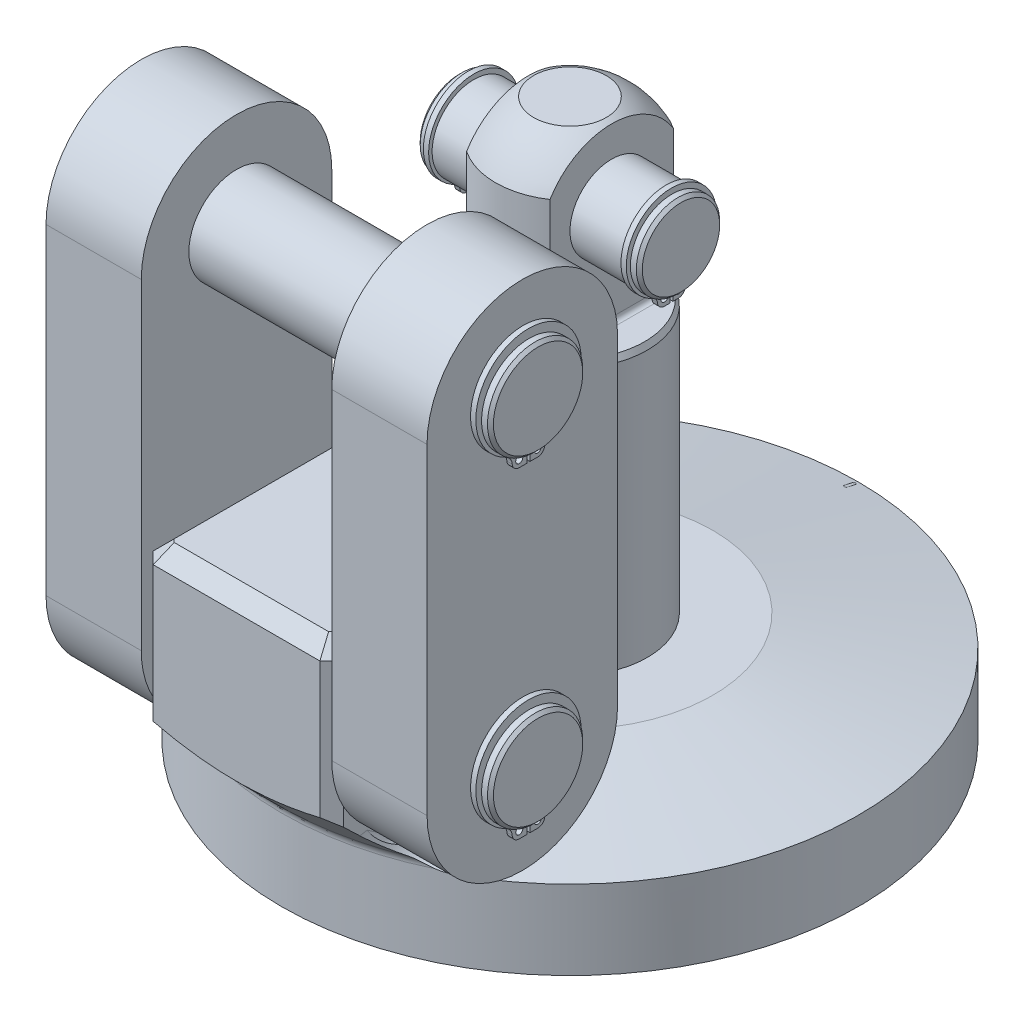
SolidWorks part; units mm, degrees
ref_plane "Front Plane" through (0, 0, 0) normal (0, 0, 1) x (1, 0, 0)
ref_plane "Top Plane" through (0, 0, 0) normal (0, 1, 0) x (1, 0, 0)
ref_plane "Right Plane" through (0, 0, 0) normal (1, 0, 0) x (0, 0, -1)
sketch "Sketch1" plane through (0, 0, 0) normal (0, 1, 0) x (1, 0, 0)
  line L0 (-16, 0) -> (16, 0)
  line L1 (16, 0) -> (16, -56)
  line L2 (16, -56) -> (-16, -56)
  line L3 (-16, -56) -> (-16, 0)
  line L4 (0, 1.05) -> (0, -22.05) construction
  dimension "D1" = 32
  dimension "D2" = 56
extrude "Extrude1" add sketch "Sketch1" along normal blind 49
sketch "S2D0003" plane through (0, 0, 0) normal (1, 0, 0) x (0, 0, -1)
  line L0 (0, 0) -> (0, 18.5)
  line L1 (-56, 0) -> (0, 0)
  line L2 (-56, 0) -> (-56, 11.6982)
  line L3 (0, 18.5) -> (-24, 18.5)
  line L4 (-24, 18.5) -> (-56, 11.6982)
  line L5 (0, 9.45) -> (0, -2.5987) construction
  line L6 (0, 49) -> (0, 0) construction
  line L8 (-56, 0) -> (0, 0) construction
  line L10 (-56, 49) -> (-56, 0) construction
  dimension "D1" = 18.5
  dimension "D2" = 12
  dimension "D3" = 48
sketch "S2D0004" plane through (0, 0, 0) normal (1, 0, 0) x (0, 0, -1)
  line L0 (-66, 31.9834) -> (-49.0508, 15.0342)
  line L1 (-48.465, 13.62) -> (-48.465, 0)
  line L2 (0, 16.6313) -> (0, -1.1122) construction
  line L3 (0, 49) -> (0, 0) construction
  line L5 (-56, 0) -> (0, 0) construction
  line L6 (-66, 31.9834) -> (-66, 0)
  line L7 (-66, 0) -> (-48.465, 0)
  line L8 (-56, 49) -> (-56, 0) construction
  arc A0 (-48.465, 13.62) -> (-49.0508, 15.0342) centre (-50.465, 13.62) ccw
  dimension "D4" = 2
  dimension "D1" = 96.93
  dimension "D2" = 13.62
  dimension "D3" = 45
  dimension "D5" = 10
sketch "Sketch4" plane through (0, 0, 0) normal (1, 0, 0) x (0, 0, -1)
  line L0 (0, 18.5) -> (24, 18.5)
  line L1 (24, 18.5) -> (24, 49)
  line L2 (24, 49) -> (0, 49)
  line L3 (0, 49) -> (0, 18.5)
  line L4 (0, 21.6) -> (0, 8.4) construction
  line L5 (0, 49) -> (0, 0) construction
  line L6 (-56, 49) -> (0, 49) construction
  dimension "D1" = 48
  dimension "D2" = 30.5
revolve "Cut-Revolve5" cut sketch "Sketch4" angle 360 about L4
revolve "Revolve1" add sketch "S2D0003" angle 360 about L5
revolve "Cut-Revolve4" cut sketch "S2D0004" angle 360 about L2
sketch "Sketch7" plane through (16, 0, 0) normal (1, 0, 0) x (0, 0, -1)
  line L0 (-48.465, 0) -> (48.465, 0) construction
  circle A0 centre (-40, 33) radius 8
  dimension "D1" = 16
  dimension "D2" = 33
  dimension "D3" = 40
extrude "Cut-Extrude3" cut sketch "Sketch7" against normal through all
fillet "Fillet1" radius 4 2 edges at (-16, 33.75, 17.8885) (16, 33.75, 17.8885)
fillet "Fillet2" radius 7.95 5 edges at (-14.0551, 18.0762, 21.8665) (0, 18.5, 24) (14.0741, 18.0719, 21.878)
chamfer "Chamfer1" distance 2 angle 45 2 edges at (-16, 36.6122, 56) (16, 36.6122, 56)
chamfer "Chamfer2" distance 2.5 angle 45 8 edges at (-16, 49, 39.6491) (-14.1381, 49, 21.9176) (0, 49, 24) (14.1381, 49, 21.9176) (-15, 49, 55) (16, 49, 39.6491) (15, 49, 55) (0, 49, 56)
ref_plane "Plane1" through (0, 0, 40) normal (0, 0, 1) x (1, 0, 0)
sketch "Sketch8" plane through (0, 0, 40) normal (0, 0, 1) x (1, 0, 0)
  line L0 (16, 33) -> (16, 16.5)
  line L1 (17.14, 15.36) -> (30.64, 15.36)
  line L2 (30.64, 15.36) -> (30.64, 33)
  line L3 (30.64, 33) -> (16, 33)
  line L4 (5.637, 33) -> (19.4125, 33) construction
  line L5 (-16, 33) -> (16, 33) construction
  line L6 (16, 49) -> (16, 24.2243) construction
  line L7 (0, 0) -> (0, 26.6501) construction
  line L8 (-30.64, 33) -> (-16, 33)
  line L9 (-30.64, 15.36) -> (-30.64, 33)
  line L10 (-17.14, 15.36) -> (-30.64, 15.36)
  line L11 (-16, 33) -> (-16, 16.5)
  arc A0 (16, 16.5) -> (17.14, 15.36) centre (17.14, 16.5) ccw
  arc A1 (-16, 16.5) -> (-17.14, 15.36) centre (-17.14, 16.5) cw
  dimension "D4" = 1.14
  dimension "D2" = 35.28
  dimension "D3" = 14.64
revolve "Cut-Revolve6" cut sketch "Sketch8" angle 360 about L4
sketch "Sketch10" plane through (0, 0, 0) normal (1, 0, 0) x (0, 0, -1)
  line L0 (0, 18.5) -> (0, 93.6)
  line L1 (0, 93.6) -> (6.1025, 93.6)
  line L2 (12.5, 87.3048) -> (12.5, 64.2723)
  line L3 (12.5, 64.2723) -> (13, 63.2)
  line L4 (13, 63.2) -> (13, 18.5)
  line L5 (13, 18.5) -> (0, 18.5)
  line L6 (0, 44.745) -> (0, 7.55) construction
  line L7 (22.759, -17.5) -> (-24.5324, -17.5) construction
  line L9 (24, 18.5) -> (-15.2237, 18.5) construction
  arc A0 (12.5, 87.3048) -> (6.1025, 93.6) centre (0, 81) ccw
  circle A1 centre (0, 81) radius 7 construction
  dimension "D2" = 14
  dimension "D3" = 14
  dimension "D5" = 98.5
  dimension "D1" = 12.6
  dimension "D4" = 36
  dimension "D6" = 26
  dimension "D7" = 25
  dimension "D8" = 25
  dimension "D9" = 30.4
  dimension "D10" = 44.7
  dimension "D11" = 75.1
revolve "Revolve2" add sketch "Sketch10" angle 360 about L6
sketch "Sketch12" plane through (0, 0, 0) normal (0, 0, 1) x (1, 0, 0)
  line L0 (7, 93.6) -> (13, 93.6)
  line L1 (13, 93.6) -> (13, 64.2)
  line L2 (13, 64.2) -> (7.8, 64.2)
  line L3 (7, 65) -> (7, 93.6)
  line L4 (6.1025, 93.6) -> (-6.1025, 93.6) construction
  line L5 (13, 18.5) -> (13, 63.2) construction
  line L6 (-7, 65) -> (-7, 93.6)
  line L7 (-13, 64.2) -> (-7.8, 64.2)
  line L8 (0, 38.525) -> (0, 26.975) construction
  line L9 (-13, 93.6) -> (-13, 64.2)
  line L10 (-7, 93.6) -> (-13, 93.6)
  arc A0 (7, 65) -> (7.8, 64.2) centre (7.8, 65) ccw
  arc A1 (-7, 65) -> (-7.8, 64.2) centre (-7.8, 65) cw
  dimension "D3" = 0.8
  dimension "D1" = 14
  dimension "D2" = 29.4
extrude "Cut-Extrude5" cut sketch "Sketch12" against normal mid plane 22
sketch "Sketch14" plane through (7, 0, 0) normal (1, 0, 0) x (0, 0, -1)
  line L0 (6.1025, 93.6) -> (-6.1025, 93.6) construction
  circle A0 centre (0, 81) radius 7
  dimension "D2" = 14
  dimension "D1" = 12.6
extrude "Cut-Extrude7" cut sketch "Sketch14" against normal up to next
sketch "S2D0005" plane through (16, 0, 0) normal (1, 0, 0) x (0, 0, -1)
  line L0 (-56.0042, 86.9988) -> (-56, 32.9988)
  line L1 (-24.0042, 87.0012) -> (-24, 33.0012)
  line L2 (-40.0042, 87) -> (-40, 33) construction
  line L3 (0, 81) -> (0.0008, 86.9944) construction
  line L4 (0.0008, 86.9944) -> (-40.0042, 87) construction
  arc A0 (-24.0042, 87.0012) -> (-56.0042, 86.9988) centre (-40.0042, 87) ccw
  arc A1 (-56, 32.9988) -> (-24, 33.0012) centre (-40, 33) ccw
  circle A2 centre (-40.0042, 87) radius 8
  circle A3 centre (-40, 33) radius 8
  circle A6 centre (-40, 33) radius 8 construction
  dimension "D2" = 54
  dimension "D1" = 32
  dimension "D3" = 40.005
  dimension "D4" = 5.9944
extrude "Extrude2" add sketch "S2D0005" along normal blind 16
sketch "S2D0006" plane through (0, 0, 0) normal (0, 0, 1) x (1, 0, 0)
  line L0 (-16.15, 88) -> (16.15, 88)
  line L1 (18.65, 87.5) -> (18.65, 81)
  line L2 (18.15, 88) -> (18.65, 87.5)
  line L3 (17.15, 88) -> (18.15, 88)
  line L4 (17.15, 87.59) -> (17.15, 88)
  line L5 (16.15, 87.59) -> (17.15, 87.59)
  line L6 (16.15, 88) -> (16.15, 87.59)
  line L7 (18.65, 81) -> (-18.65, 81)
  line L8 (-16.15, 88) -> (-16.15, 87.59)
  line L9 (-16.15, 87.59) -> (-17.15, 87.59)
  line L10 (-17.15, 87.59) -> (-17.15, 88)
  line L11 (-17.15, 88) -> (-18.15, 88)
  line L12 (-18.15, 88) -> (-18.65, 87.5)
  line L13 (-18.65, 87.5) -> (-18.65, 81)
  line L14 (-8.415, 81) -> (8.415, 81) construction
  line L15 (-7, 81) -> (7, 81) construction
  line L16 (0, 40.8686) -> (0, 24.9357) construction
  line L17 (0, 64.2723) -> (0, 87.3048) construction
  line L18 (7, 88) -> (-7, 88) construction
  dimension "D1" = 37.3
  dimension "D3" = 1
  dimension "D4" = 13.18
  dimension "D5" = 32.3
  dimension "D6" = 0.5
  dimension "D7" = 45
revolve "Revolve3" add sketch "S2D0006" angle 360 about L14
ref_plane "Plane2" through (0, 0, 40) normal (0, 0, 1) x (1, 0, 0)
sketch "Sketch18" plane through (0, 0, 40) normal (0, 0, 1) x (1, 0, 0)
  line L0 (-32.15, 41) -> (32.15, 41)
  line L1 (34.65, 40.5) -> (34.65, 33)
  line L2 (34.15, 41) -> (34.65, 40.5)
  line L3 (33.15, 41) -> (34.15, 41)
  line L4 (33.15, 40.1) -> (33.15, 41)
  line L5 (32.15, 40.1) -> (33.15, 40.1)
  line L6 (32.15, 41) -> (32.15, 40.1)
  line L7 (-32.15, 41) -> (-32.15, 40.1)
  line L8 (-32.15, 40.1) -> (-33.15, 40.1)
  line L9 (-33.15, 40.1) -> (-33.15, 41)
  line L10 (-33.15, 41) -> (-34.15, 41)
  line L11 (-34.15, 41) -> (-34.65, 40.5)
  line L12 (-34.65, 40.5) -> (-34.65, 33)
  line L13 (-13.915, 33) -> (13.915, 33) construction
  line L14 (-16, 33) -> (32, 33) construction
  line L15 (0, 28.7058) -> (0, -18.8155) construction
  line L16 (-34.65, 33) -> (34.65, 33)
  line L17 (32, 41) -> (-16, 41) construction
  dimension "D2" = 69.3
  dimension "D3" = 14.2
  dimension "D4" = 1
  dimension "D5" = 64.3
  dimension "D6" = 0.5
  dimension "D7" = 45
revolve "Revolve4" add sketch "Sketch18" angle 360 about L13
sketch "Sketch20" plane through (16.15, 0, 0) normal (1, 0, 0) x (0, 0, -1)
  line L0 (0.25, 72.1998) -> (1.1505, 72.1998)
  line L1 (0.25, 74.5398) -> (0.25, 72.1998)
  line L2 (-0.25, 74.5398) -> (-0.25, 72.1998)
  line L3 (-0.25, 72.1998) -> (-1.1505, 72.1998)
  line L4 (0, 30.527) -> (0, 23.2449) construction
  line L5 (3.0495, 74.2806) -> (2.6718, 75.1129) construction
  line L6 (0, 81) -> (0, 73.3706) construction
  arc A0 (0.25, 74.5398) -> (-0.25, 74.5398) centre (0, 81) ccw
  arc A1 (3.0495, 74.2806) -> (-3.0495, 74.2806) centre (0, 81.2258) ccw
  circle A2 centre (0, 81) radius 7 construction
  circle A3 centre (1.1505, 73.3938) radius 0.597
  arc A4 (2.34, 73.2906) -> (1.1505, 72.1998) centre (1.1505, 73.3938) cw
  arc A5 (-2.34, 73.2906) -> (-3.0495, 74.2806) centre (-3.5295, 73.1874) ccw
  arc A6 (-2.34, 73.2906) -> (-1.1505, 72.1998) centre (-1.1505, 73.3938) ccw
  circle A7 centre (-1.1505, 73.3938) radius 0.597
  arc A8 (2.34, 73.2906) -> (3.0495, 74.2806) centre (3.5295, 73.1874) cw
  point P4 (0, 87.465)
  point P18 (0, 88.811)
extrude "Extrude4" add sketch "Sketch20" along normal blind 0.889
sketch "Sketch21" plane through (32.15, 0, 0) normal (1, 0, 0) x (0, 0, -1)
  line L0 (-39.7492, 22.9143) -> (-38.4469, 22.9144)
  line L1 (-39.7494, 25.6543) -> (-39.7492, 22.9143)
  line L2 (-40.2494, 25.6542) -> (-40.2492, 22.9142)
  line L3 (-40.2492, 22.9142) -> (-41.5515, 22.9141)
  line L4 (-39.9984, 12.382) -> (-39.998, 6.414) construction
  line L5 (-56.0042, 86.9988) -> (-56, 32.9988) construction
  line L6 (-40.0006, 40.35) -> (-40.0007, 42.382) construction
  line L7 (-36.2233, 25.5354) -> (-36.6818, 26.4416) construction
  line L8 (-40, 33) -> (-40, 22.8621) construction
  arc A0 (-39.7494, 25.6543) -> (-40.2494, 25.6542) centre (-40, 33) ccw
  arc A1 (-36.2233, 25.5354) -> (-43.7755, 25.5348) centre (-40, 33.5354) ccw
  circle A2 centre (-38.447, 24.1044) radius 0.595
  arc A3 (-37.26, 24.0205) -> (-38.4469, 22.9144) centre (-38.447, 24.1044) cw
  arc A4 (-37.26, 24.0205) -> (-36.2233, 25.5354) centre (-35.4477, 23.8924) cw
  arc A5 (-42.7386, 24.0201) -> (-43.7755, 25.5348) centre (-44.5509, 23.8917) ccw
  arc A6 (-42.7386, 24.0201) -> (-41.5515, 22.9141) centre (-41.5516, 24.1041) ccw
  circle A7 centre (-41.5516, 24.1041) radius 0.595
  circle A8 centre (-40, 33) radius 8 construction
extrude "Extrude5" add sketch "Sketch21" along normal blind 0.889
pattern_linear "LPattern1" count 2 spacing 54 along (0, 1, 0.0001) of "Extrude5", "Revolve4"
mirror "Mirror1" about plane through (0, 0, 0) normal (1, 0, 0) of "Extrude5", "LPattern1", "Extrude4", "Extrude2"
sketch "Sketch22" plane through (0, 0, 0) normal (1, 0, 0) x (0, 0, -1)
  line L0 (47.7394, 14.231) -> (45.4108, 14.726) construction
  line L1 (48.465, 13.2998) -> (24, 18.5) construction
  line L2 (47.9759, 13.4038) -> (46.0196, 13.8196) construction
  line L3 (46.422, 14.511) -> (47.8896, 14.1991) construction
  line L5 (46.2557, 13.7285) -> (47.7233, 13.4166)
  line L6 (45.6395, 14.6774) -> (48.6721, 14.0328)
  arc A0 (45.6395, 14.6774) -> (46.2557, 13.7285) centre (46.422, 14.511) ccw
  arc A1 (47.7233, 13.4166) -> (48.6721, 14.0328) centre (47.8896, 14.1991) ccw
  dimension "D2" = 1.6
  dimension "D1" = 0.76
  dimension "D3" = 2
  dimension "D4" = 0.5
revolve "Cut-Revolve7" cut sketch "Sketch22" angle 360 about L6
equation "\"D4@Sketch20\"=\"D7@Sketch20\""
equation "\"D9@Sketch20\"=\"D6@Sketch20\""
equation "\"D9@Sketch21\"=\"D5@Sketch21\""
equation "\"D7@Sketch21\"=\"D8@Sketch21\""
